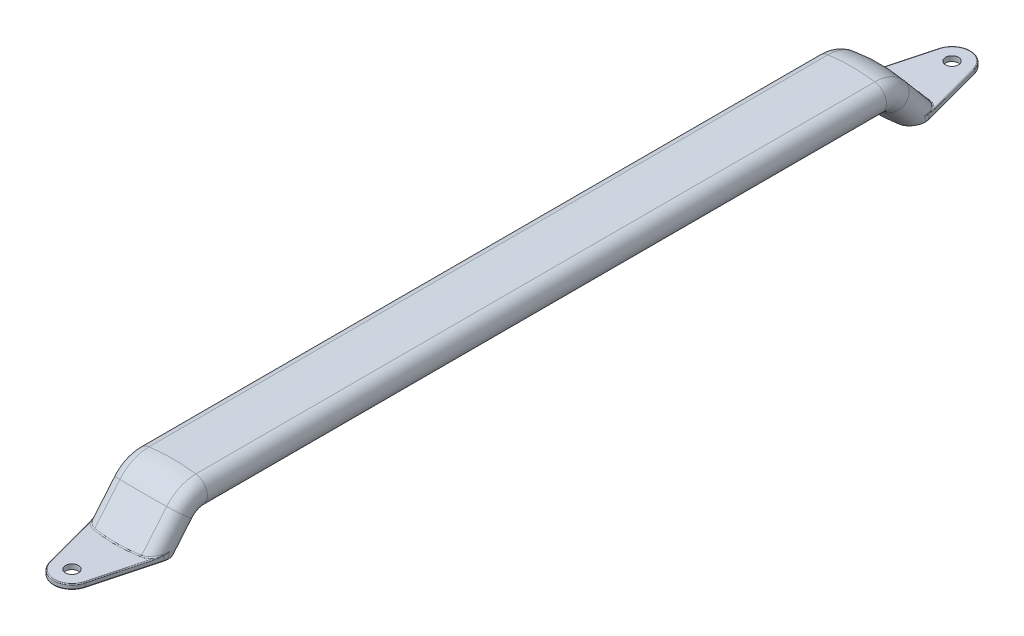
SolidWorks part; units mm, degrees
ref_plane "Front Plane" through (0, 0, 0) normal (0, 0, 1) x (1, 0, 0)
ref_plane "Top Plane" through (0, 0, 0) normal (0, 1, 0) x (1, 0, 0)
ref_plane "Right Plane" through (0, 0, 0) normal (1, 0, 0) x (0, 0, -1)
sketch "Sketch1" plane through (0, 0, 0) normal (1, 0, 0) x (0, 0, -1)
  line L0 (-204.0027, 0) -> (0, 0)
  line L1 (-215.4934, -5.3582) -> (-237.9909, -32.1697)
  line L2 (0, 0) -> (0, 128.2228) construction
  arc A0 (-204.0027, 0) -> (-215.4934, -5.3582) centre (-204.0027, -15) ccw
  point P4 (0, 0)
  point P10 (-210.9973, 0)
  dimension "D4" = 15
  dimension "D1" = 35
  dimension "D3" = 130
ref_plane "Plane1" through (0, -32.1697, 237.9909) normal (0, -0.766, 0.6428) x (-1, 0, 0)
sketch "Sketch2" plane through (0, -32.1697, 237.9909) normal (0, -0.766, 0.6428) x (-1, 0, 0)
  line L0 (-17, 0) -> (17, 0) construction
  arc A0 (-14.0735, 7.9277) -> (-14.0735, -7.9277) centre (-13, 0) ccw
  arc A1 (14.0735, -7.9277) -> (14.0735, 7.9277) centre (13, 0) ccw
  arc A2 (-14.0735, 7.9277) -> (14.0735, 7.9277) centre (0, -96.0065) cw
  arc A3 (-14.0735, -7.9277) -> (14.0735, -7.9277) centre (0, 96.0065) ccw
  point P2 (0, 0)
  dimension "D1" = 8
  dimension "D2" = 34
sweep "Sweep2" add profiles "Sketch2" path "Sketch1"
ref_plane "Plane2" through (0, -20, 0) normal (0, 1, 0) x (1, 0, 0)
sketch "Sketch3" plane through (0, -20, 0) normal (0, 1, 0) x (1, 0, 0)
  line L0 (-21, -201.8996) -> (21, -201.8996)
  line L2 (21, -201.8996) -> (21, -275.8996)
  line L3 (21, -275.8996) -> (-21, -275.8996)
  line L4 (-21, -275.8996) -> (-21, -201.8996)
  line L6 (0, -206.563) -> (0, -260.1389) construction
  point P3 (0, -206.563)
  dimension "D1" = 42
  dimension "D2" = 74
  dimension "D3" = 201.8996
extrude "Boss-Extrude1" add sketch "Sketch3" along normal mid plane 3
sketch "Sketch5" plane through (0, -18.5, 0) normal (0, 1, 0) x (1, 0, 0)
  line L0 (-21, -205.4187) -> (21, -205.4187)
  line L1 (0, -201.5207) -> (0, -275.8996) construction
  line L2 (-21, -275.8996) -> (21, -275.8996) construction
  line L10 (-21, -205.4187) -> (-21, -227.2089)
  line L11 (-20.6617, -229.788) -> (-10.6685, -267.2245)
  line L12 (20.6617, -229.788) -> (10.6685, -267.2245)
  line L14 (21, -205.4187) -> (21, -227.2089)
  arc A0 (-10.6685, -267.2245) -> (10.6685, -267.2245) centre (0, -264.3766) ccw
  arc A1 (-20.6617, -229.788) -> (-21, -227.2089) centre (-11, -227.2089) cw
  arc A2 (20.6617, -229.788) -> (21, -227.2089) centre (11, -227.2089) ccw
  point P2 (0, -275.4187)
  dimension "D1" = 10
  dimension "D2" = 70
  dimension "D3" = 42
  dimension "D4" = 205.4187
extrude "Cut-Extrude1" cut sketch "Sketch5" against normal blind 18 flip side to cut
other "DeleteFace1"
sketch "Sketch7" plane through (0, 0, 0) normal (1, 0, 0) x (0, 0, -1)
  line L0 (-275.4187, -21.5) -> (-204.9315, -21.5)
  line L1 (-204.9315, -21.5) -> (-204.9315, -47.2593)
  line L2 (-204.9315, -47.2593) -> (-275.4187, -47.2593)
  line L3 (-275.4187, -47.2593) -> (-275.4187, -21.5)
  line L4 (-275.4187, -18.5) -> (-275.4187, -21.5) construction
  dimension "D1" = 70.4872
  dimension "D2" = 25.7593
extrude "Cut-Extrude2" cut sketch "Sketch7" against normal mid plane 98
sketch "Sketch8" plane through (0, -18.5, 0) normal (0, 1, 0) x (1, 0, 0)
  circle A0 centre (0, -264.3766) radius 3.9
  dimension "D1" = 7.8
extrude "Cut-Extrude3" cut sketch "Sketch8" against normal blind 10
fillet "Fillet4" radius 1 3 edges at (-18.93, -18.5, 233.5304) (0, -18.5, 238.1076) (18.93, -18.5, 233.5304)
fillet "Fillet5" radius 0.5 7 edges at (-20.9975, -17.8317, 226.984) (-20.0773, -18.3844, 231.9772) (-15.1549, -18.5, 250.4175) (0, -18.5, 275.4187) (20.9858, -17.701, 226.6769) (20.2268, -18.3184, 231.4173) (15.1549, -18.5, 250.4175)
fillet "Fillet6" radius 0.5 5 edges at (20.8513, -21.5, 228.9271) (-20.8513, -21.5, 228.9271) (-15.6651, -21.5, 248.5062) (0, -21.5, 275.4187) (15.6651, -21.5, 248.5062)
mirror "Mirror3" about plane through (0, 0, 0) normal (0, 0, 1)
sketch "Sketch10" plane through (0, 0, 0) normal (0, 1, 0) x (1, 0, 0)
  line L0 (0, 264.3766) -> (0, -264.3766) construction
